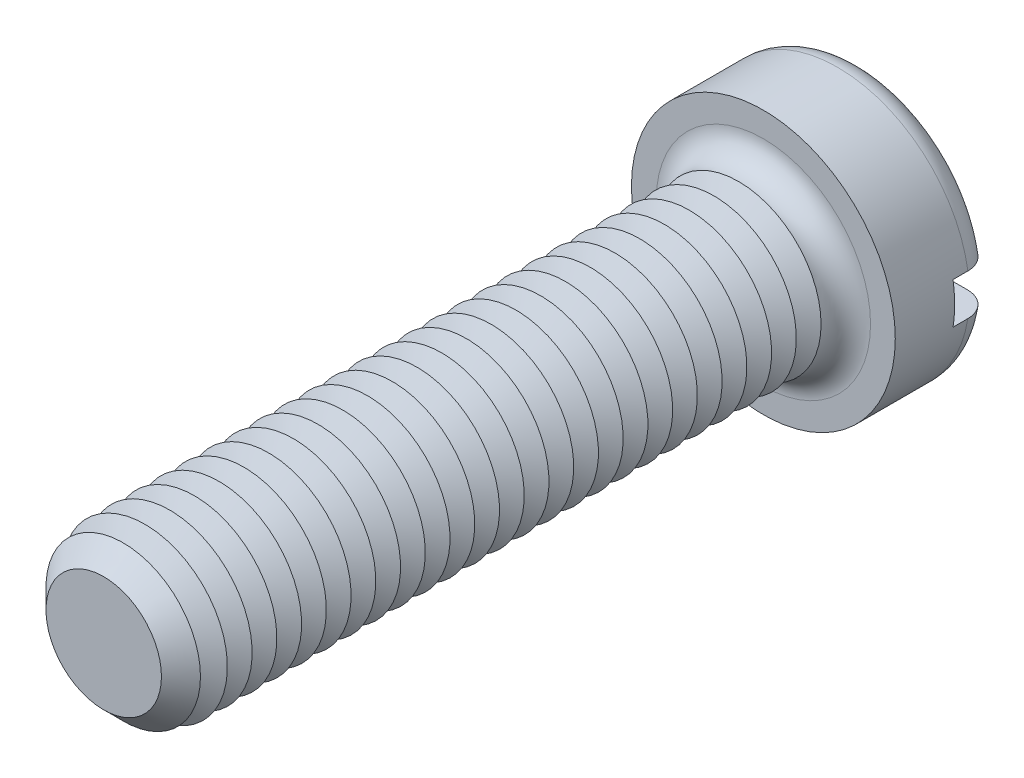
SolidWorks part; units mm, degrees
ref_plane "Front Plane" through (0, 0, 0) normal (0, 0, 1) x (1, 0, 0)
ref_plane "Top Plane" through (0, 0, 0) normal (0, 1, 0) x (1, 0, 0)
ref_plane "Right Plane" through (0, 0, 0) normal (1, 0, 0) x (0, 0, -1)
sketch "Sketch3" plane through (0, 0, 0) normal (0, 0, 1) x (1, 0, 0)
  circle A0 centre (0, 0) radius 8
  dimension "D1" = 16
extrude "Boss-Extrude2" add sketch "Sketch3" against normal blind 6
sketch "Sketch4" plane through (0, 0, 0) normal (0, 0, 1) x (1, 0, 0)
  circle A0 centre (0, 0) radius 5
  dimension "D1" = 10
extrude "Boss-Extrude3" add sketch "Sketch4" along normal blind 40
fillet "Fillet1" radius 1.5 2 edges at (8, 0, -6) (5, 0, 0)
chamfer "Chamfer1" distance 1.5 angle 45 1 edges at (5, 0, 40)
sketch "Sketch5" plane through (0, 0, 0) normal (1, 0, 0) x (0, 0, -1)
  line L0 (1.6944, 0) -> (-7.6738, 0) construction
sketch "Sketch6" plane through (0, 0, 0) normal (1, 0, 0) x (0, 0, -1)
  line L0 (-1.5, 5) -> (-2.25, 3.701)
  line L1 (-2.25, 3.701) -> (-3, 5)
  line L2 (-1.5, 5) -> (-38.5, 5) construction
  line L3 (-3, 5) -> (-1.5, 5)
  dimension "D1" = 1.5
revolve "Cut-Revolve1" cut sketch "Sketch6" angle 360 about L0
pattern_linear "LPattern1" count 25 spacing 1.5 along (0, 0, 1) of "Cut-Revolve1"
sketch "Sketch8" plane through (0, 0, -6) normal (0, 0, -1) x (-1, 0, 0)
  line L1 (8, -1.25) -> (-8, -1.25)
  line L2 (8, -1.25) -> (8, 1.25)
  line L3 (8, 1.25) -> (-8, 1.25)
  line L4 (-8, -1.25) -> (-8, 1.25)
  line L5 (8, -1.25) -> (-8, 1.25) construction
  line L6 (8, 1.25) -> (-8, -1.25) construction
  point P0 (0, 0)
  dimension "D1" = 16
  dimension "D2" = 2.5
extrude "Cut-Extrude1" cut sketch "Sketch8" against normal blind 2.4
